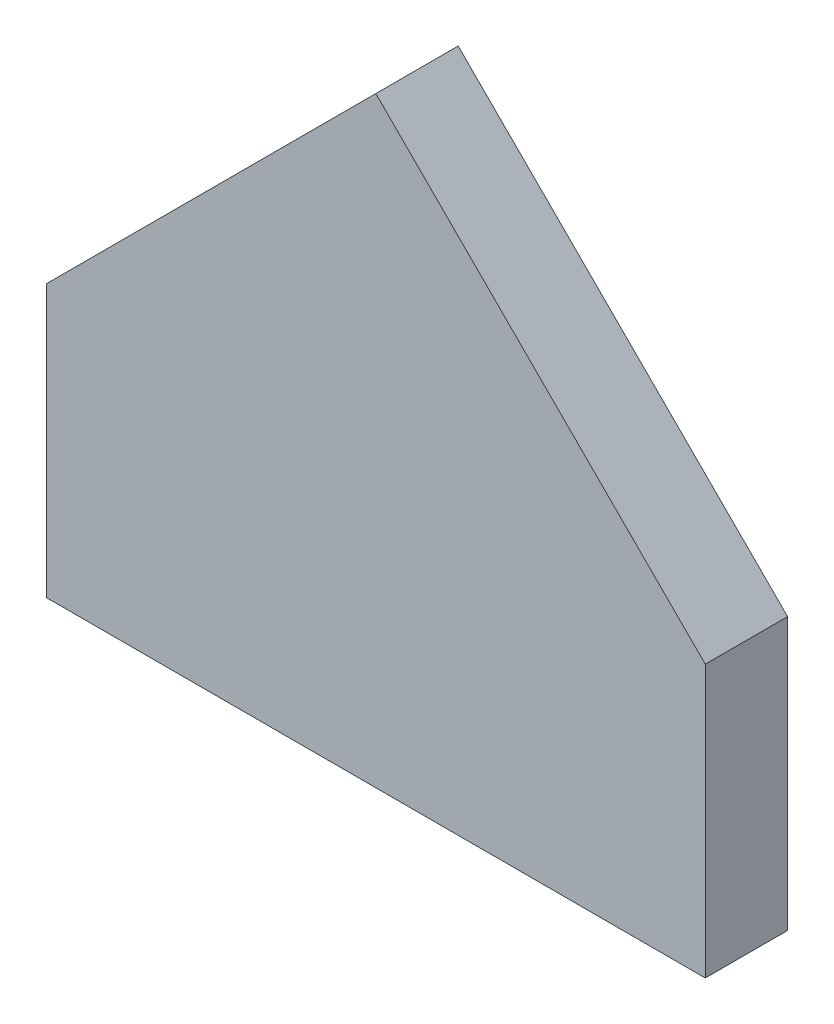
SolidWorks part; units mm, degrees
ref_plane "Plan de face" through (0, 0, 0) normal (0, 0, 1) x (1, 0, 0)
ref_plane "Plan de dessus" through (0, 0, 0) normal (0, 1, 0) x (1, 0, 0)
ref_plane "Plan de droite" through (0, 0, 0) normal (1, 0, 0) x (0, 0, -1)
sketch "Esquisse1" plane through (0, 0, 0) normal (0, 0, 1) x (1, 0, 0)
  line L0 (0, 0) -> (40, 0)
  line L1 (40, 0) -> (40, 16.5)
  line L2 (40, 16.5) -> (20, 36.5)
  line L3 (20, 36.5) -> (0, 16.5)
  line L4 (0, 16.5) -> (0, 0)
  dimension "D2" = 16.5
  dimension "D3" = 16.5
  dimension "D4" = 36.5
  dimension "D5" = 20
extrude "Extrusion2" add sketch "Esquisse1" along normal blind 5
